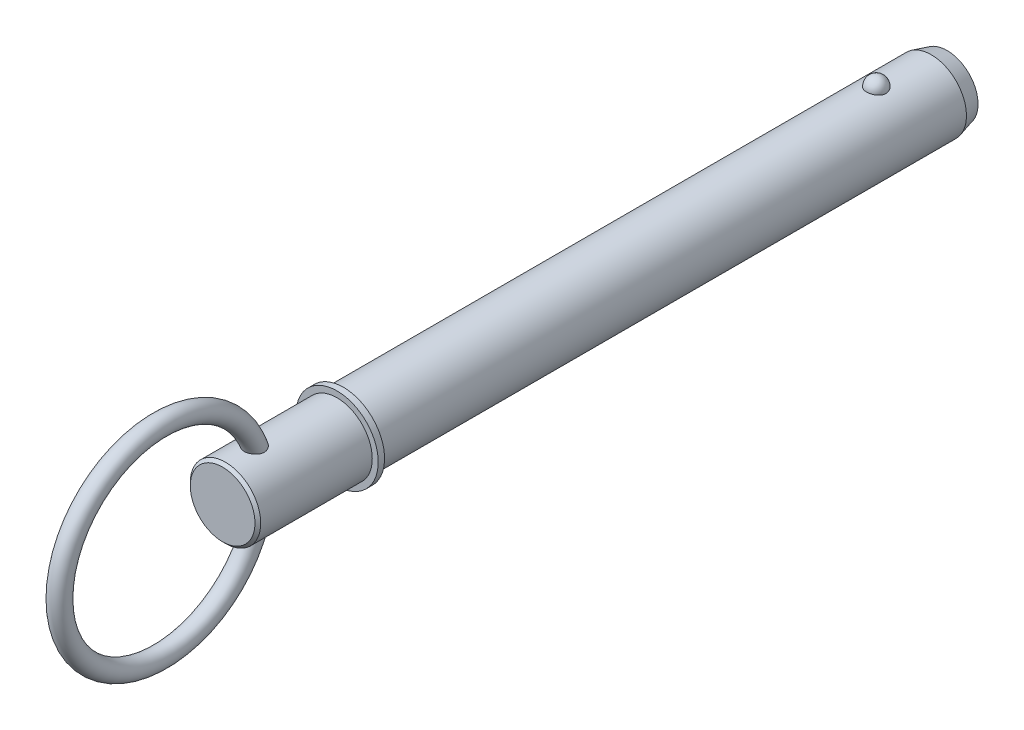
SolidWorks part; units mm, degrees
ref_plane "Front Plane" through (0, 0, 0) normal (0, 0, 1) x (1, 0, 0)
ref_plane "Top Plane" through (0, 0, 0) normal (0, 1, 0) x (1, 0, 0)
ref_plane "Right Plane" through (0, 0, 0) normal (1, 0, 0) x (0, 0, -1)
sketch "Sketch2" plane through (0, 0, 0) normal (0, 0, 1) x (1, 0, 0)
  circle A0 centre (0, 0) radius 11.115
  point P3 (0, 11.115)
  dimension "D1" = 22.23
extrude "Boss-Extrude1" add sketch "Sketch2" along normal blind 165.1
sketch "Sketch3" plane through (0, 0, 0) normal (0, 0, -1) x (-1, 0, 0)
  circle A0 centre (0, 0) radius 11.115
  dimension "D1" = 22.23
extrude "Boss-Extrude2" add sketch "Sketch3" along normal blind 25.4
chamfer "Chamfer1" distance 5 angle 15 1 edges at (-11.115, 0, -25.4)
sketch "Sketch18" plane through (0, 0, 0) normal (1, 0, 0) x (0, 0, -1)
  line L0 (20.4, 11.115) -> (-165.1, 11.115) construction
  line L1 (3.07, 14.185) -> (3.07, 8.045)
  line L2 (-165.1, -11.115) -> (20.4, -11.115) construction
  arc A0 (3.07, 14.185) -> (3.07, 8.045) centre (3.07, 11.115) ccw
  point P4 (0, 11.115)
  dimension "D1" = 25.3
revolve "Revolve1" add sketch "Sketch18" angle 360 about L1
sketch "Sketch19" plane through (0, 0, 0) normal (1, 0, 0) x (0, 0, -1)
  line L0 (-33.7288, 0) -> (-46.4542, 0) construction
sketch "Sketch20" plane through (0, 0, 0) normal (1, 0, 0) x (0, 0, -1)
  line L0 (-165.1, 0) -> (-165.1, 13)
  line L1 (-165.1, 11.115) -> (-165.1, -11.115) construction
  line L2 (-165.1, 13) -> (-167.1, 13)
  line L3 (-167.1, 13) -> (-167.1, 0)
  line L4 (-33.7288, 0) -> (-46.4542, 0) construction
  line L5 (-167.1, 0) -> (-165.1, 0)
  dimension "D1" = 13
  dimension "D2" = 2
revolve "Revolve2" add sketch "Sketch20" angle 360 about L0
sketch "Sketch21" plane through (0, 0, 165.1) normal (0, 0, -1) x (-1, 0, 0)
  circle A0 centre (0, 0) radius 11.115
  dimension "D1" = 22.23
extrude "Boss-Extrude3" add sketch "Sketch21" against normal blind 38.1
chamfer "Chamfer2" distance 0.9 angle 45 1 edges at (-11.115, 0, 203.2)
sketch "Sketch23" plane through (0, 0, 0) normal (1, 0, 0) x (0, 0, -1)
  line L0 (-203.2, 10.215) -> (-203.2, -10.215) construction
  circle A0 centre (-222.95, 0) radius 31.75
  point P2 (-191.2, 0)
  dimension "D1" = 63.5
  dimension "D2" = 12
sketch "Sketch24" plane through (0, 0, 0) normal (0, 1, 0) x (1, 0, 0)
  circle A0 centre (0, -191.2) radius 3
  dimension "D1" = 6
sweep "Sweep1" add profiles "Sketch24" path "Sketch23"
